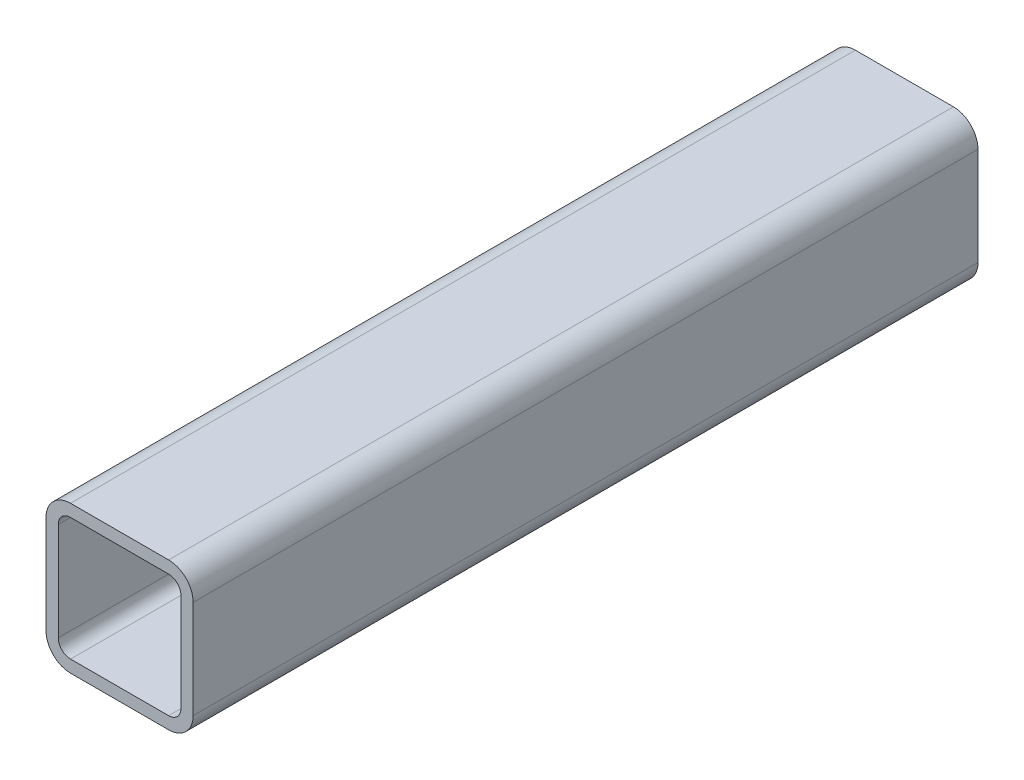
SolidWorks part; units mm, degrees
ref_plane "Front Plane" through (0, 0, 0) normal (0, 0, 1) x (1, 0, 0)
ref_plane "Top Plane" through (0, 0, 0) normal (0, 1, 0) x (1, 0, 0)
ref_plane "Right Plane" through (0, 0, 0) normal (1, 0, 0) x (0, 0, -1)
sketch "Sketch1" plane through (0, 0, 0) normal (0, 0, 1) x (1, 0, 0)
sketch_block_instance "HSS2.25x2.25x0.1875-1"
sketch_block "HSS2.25x2.25x0.1875"
extrude "Boss-Extrude1" add sketch "Sketch1" along normal blind 304.8
